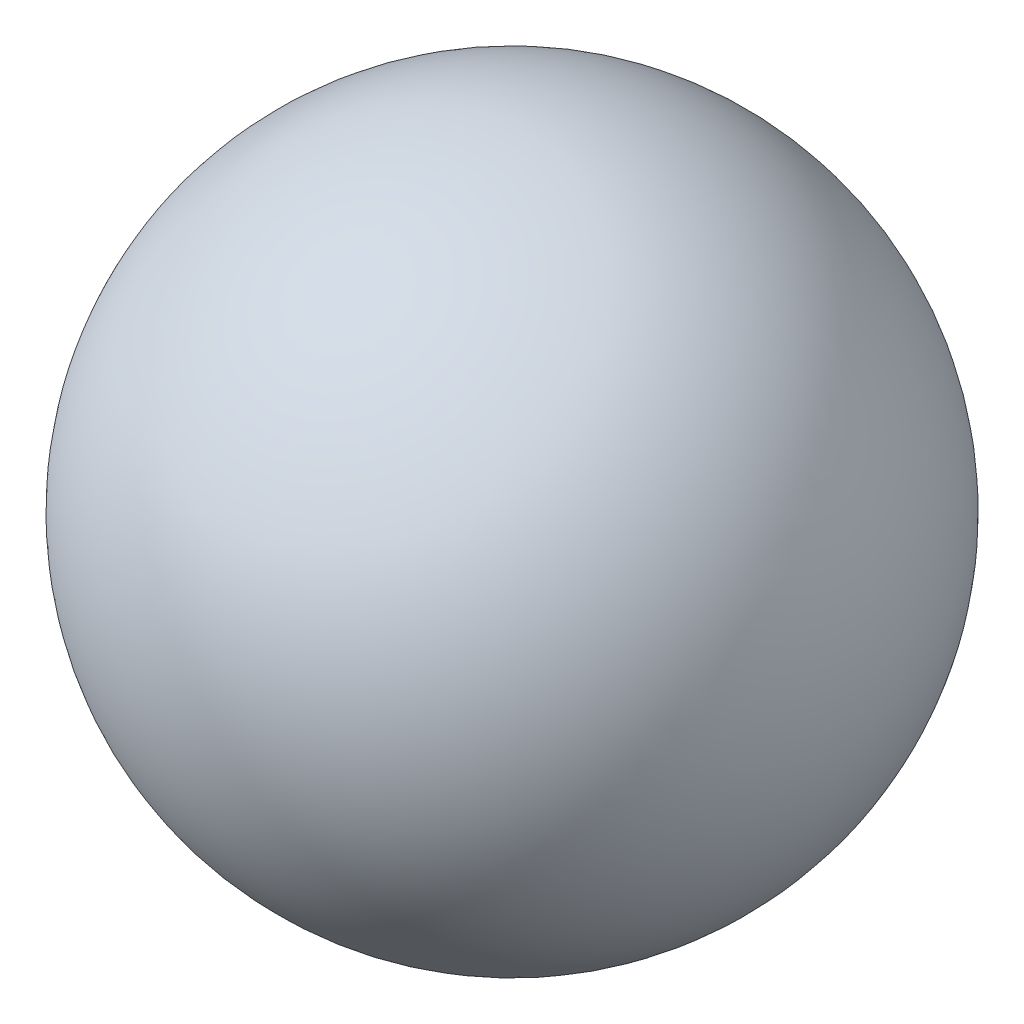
SolidWorks part; units mm, degrees
ref_plane "Plan de face" through (0, 0, 0) normal (0, 0, 1) x (1, 0, 0)
ref_plane "Plan de dessus" through (0, 0, 0) normal (0, 1, 0) x (1, 0, 0)
ref_plane "Plan de droite" through (0, 0, 0) normal (1, 0, 0) x (0, 0, -1)
sketch "Esquisse1" plane through (0, 0, 0) normal (0, 0, 1) x (1, 0, 0)
  line L0 (1.6, 10) -> (6.4, 10)
  line L1 (1.6, 10) -> (6.4, 10) construction
  arc A0 (6.4, 10) -> (1.6, 10) centre (4, 10) cw
revolve "Révolution1" add sketch "Esquisse1" angle 360 about L1
